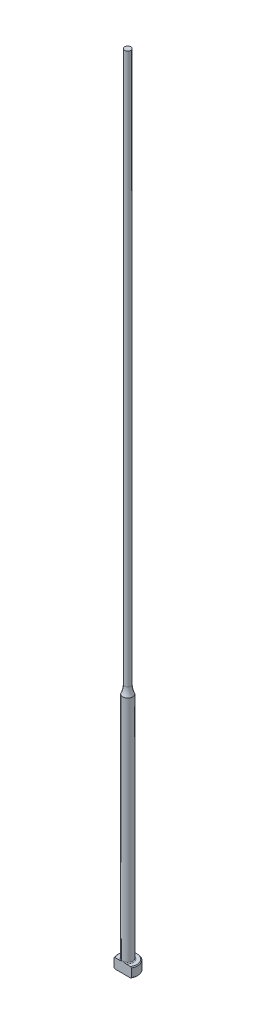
SolidWorks part; units mm, degrees
ref_plane "Front Plane" through (0, 0, 0) normal (0, 0, 1) x (1, 0, 0)
ref_plane "Top Plane" through (0, 0, 0) normal (0, 1, 0) x (1, 0, 0)
ref_plane "Right Plane" through (0, 0, 0) normal (1, 0, 0) x (0, 0, -1)
sketch "Sketch1" plane through (0, 0, 0) normal (0, 0, 1) x (1, 0, 0)
  line L0 (0, 259.9588) -> (0, -15.1925) construction
  line L1 (0, 0) -> (-3.175, 0)
  line L2 (-3.175, 0) -> (-3.175, 3.175)
  line L3 (-3.175, 3.175) -> (-1.5875, 3.175)
  line L4 (-0.9919, 78.8851) -> (-0.9919, 254)
  line L5 (-0.9919, 254) -> (0, 254)
  line L6 (0, 254) -> (0, 0)
  line L7 (-1.5875, 3.175) -> (-1.5875, 76.2)
  arc A0 (-1.5875, 76.2) -> (-0.9919, 78.8851) centre (-7.3419, 78.8851) ccw
  point P13 (-1.5875, 0)
  dimension "D1" = 6.35
  dimension "L" = 254
  dimension "D2" = 3.175
  dimension "H" = 6.35
  dimension "T" = 3.175
  dimension "D" = 1.9837
  dimension "S" = 76.2
revolve "Revolve1" add sketch "Sketch1" angle 360 about L0
chamfer "Chamfer1" distance 0.254 angle 45 2 edges at (0, 3.175, 3.175) (0, 0, 3.175)
fillet "Fillet1" radius 0.254 1 edges at (0, 3.175, 1.5875)
sketch "Sketch2" plane through (0, 0, 0) normal (0, -1, 0) x (1, 0, 0)
  line L0 (-2.7496, 1.5875) -> (2.7496, 1.5875)
  arc A0 (2.7496, 1.5875) -> (-2.7496, 1.5875) centre (0, 0) ccw
  circle A1 centre (0, 0) radius 3.175 construction
  circle A2 centre (0, 0) radius 1.5875 construction
extrude "Cut-Extrude1" cut sketch "Sketch2" against normal through all
